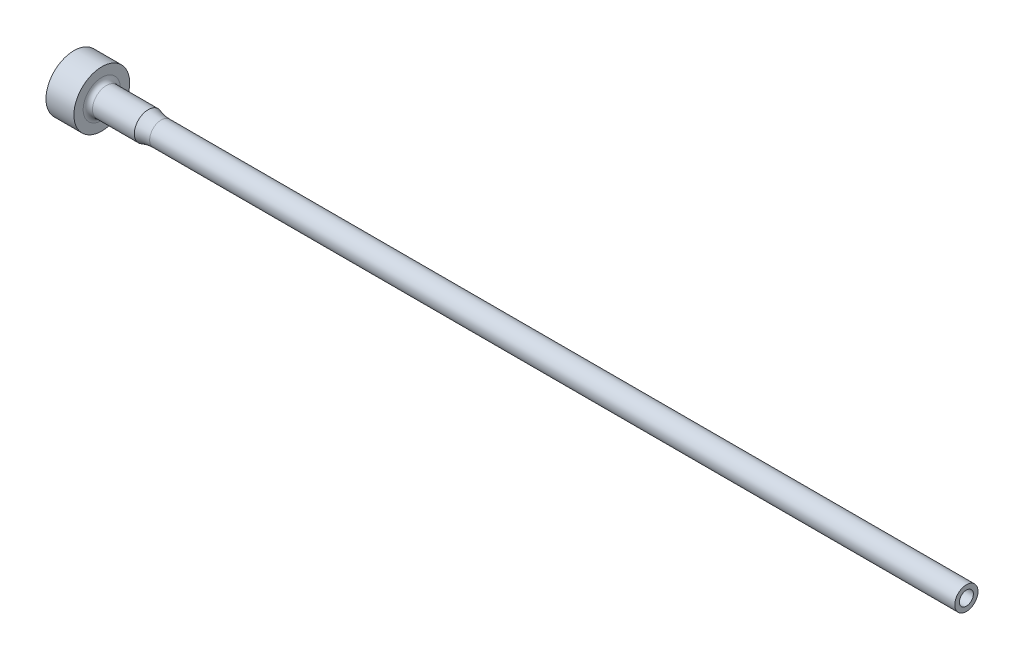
SolidWorks part; units mm, degrees
ref_plane "Front Plane" through (0, 0, 0) normal (0, 0, 1) x (1, 0, 0)
ref_plane "Top Plane" through (0, 0, 0) normal (0, 1, 0) x (1, 0, 0)
ref_plane "Right Plane" through (0, 0, 0) normal (1, 0, 0) x (0, 0, -1)
sketch "Sketch1" plane through (0, 0, 0) normal (0, 0, 1) x (1, 0, 0)
  line L0 (101.6, 0) -> (25.4, 0) construction
  line L1 (0, 4.7625) -> (0, 2.0796)
  line L2 (0, 2.0796) -> (0.762, 1.3176)
  line L3 (0.762, 1.3176) -> (107.8767, 1.3176)
  line L4 (107.8767, 1.3176) -> (107.95, 1.1906)
  line L5 (107.95, 1.1906) -> (152.4, 1.1906)
  line L6 (152.4, 1.1906) -> (152.4, 1.985)
  line L7 (152.4, 1.985) -> (14.925, 1.985)
  line L8 (4.7625, 3.1813) -> (4.7625, 4.7625)
  line L9 (4.7625, 4.7625) -> (0, 4.7625)
  line L10 (5.5562, 2.3876) -> (12.7, 2.3876)
  line L11 (107.95, 1.1906) -> (55.2898, 1.1906) construction
  arc A1 (12.7, 2.3876) -> (14.925, 1.985) centre (14.925, 8.335) ccw
  arc A2 (4.7625, 3.1813) -> (5.5562, 2.3876) centre (5.5562, 3.1813) ccw
  dimension "D4" = 2.3876
  dimension "D7" = 12.7
  dimension "D8" = 0.7937
  dimension "D1" = 0.762
  dimension "HeadThickness" = 4.7625
  dimension "HeadDia" = 9.525
  dimension "OverallLength" = 152.4
  dimension "ID" = 2.3813
  dimension "OD" = 3.97
  dimension "BearingSurf" = 44.45
  dimension "D2" = 60
  dimension "D3" = 0.127
  dimension "D5" = 45
  dimension "S1" = 12.7
revolve "Revolve1" add sketch "Sketch1" angle 360 about L0
